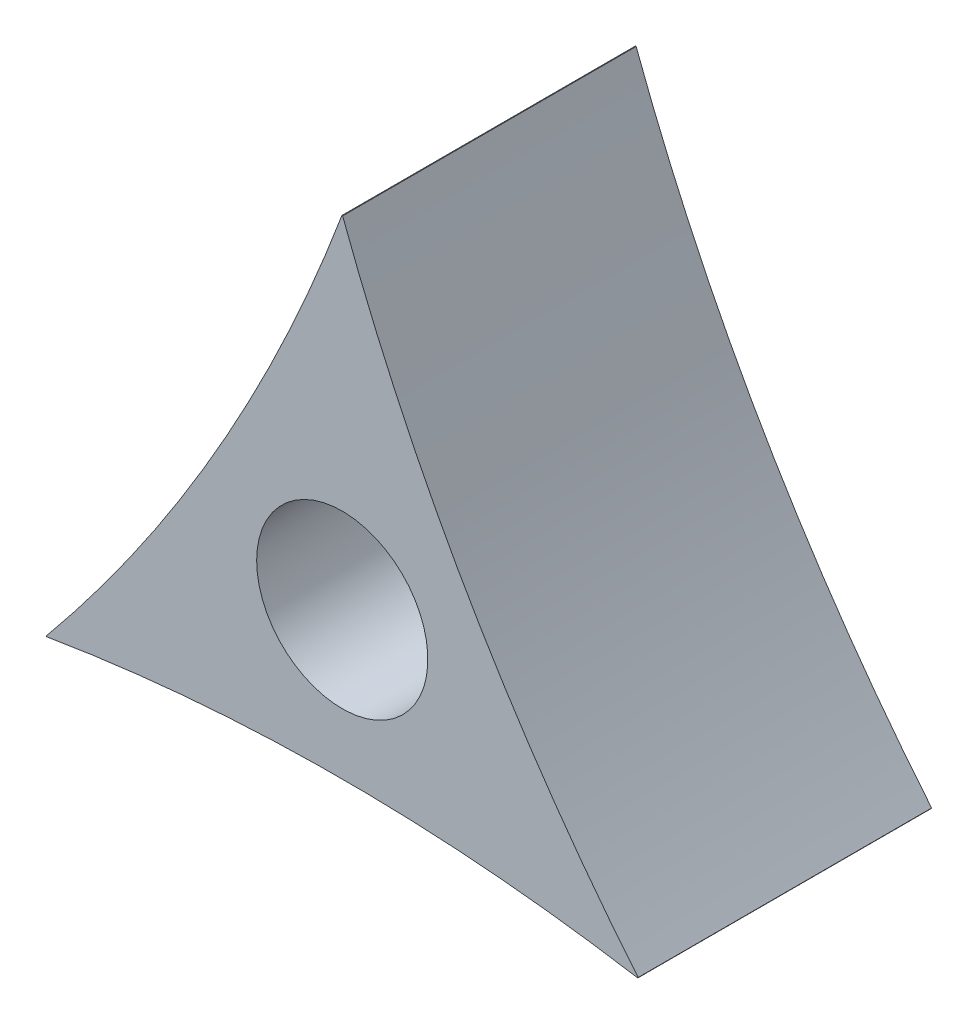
SolidWorks part; units mm, degrees
ref_plane "Front Plane" through (0, 0, 0) normal (0, 0, 1) x (1, 0, 0)
ref_plane "Top Plane" through (0, 0, 0) normal (0, 1, 0) x (1, 0, 0)
ref_plane "Right Plane" through (0, 0, 0) normal (1, 0, 0) x (0, 0, -1)
sketch "Sketch1" plane through (0, 0, 0) normal (0, 0, 1) x (1, 0, 0)
  line L0 (0, 0) -> (0, 177.8) construction
  line L1 (0, 0) -> (153.9793, -88.9) construction
  line L2 (0, 0) -> (-153.9793, -88.9) construction
  arc A0 (153.9793, -88.9) -> (-153.9793, -88.9) centre (0, -1005.6993) ccw
  arc A1 (153.9793, -88.9) -> (0, 177.8) centre (870.9611, 502.8496) cw
  arc A2 (0, 177.8) -> (-153.9793, -88.9) centre (-870.9611, 502.8496) cw
  circle A3 centre (0, 0) radius 44.45
extrude "Boss-Extrude1" add sketch "Sketch1" along normal blind 152.4
sketch "Sketch2" plane through (0, 0, 152.4) normal (0, 0, 1) x (1, 0, 0)
  line L0 (154.3603, -88.2401) -> (153.5983, -89.5599)
  line L1 (0, 0) -> (153.9793, -88.9) construction
  line L2 (0, 0) -> (0, 9.1868) construction
  line L4 (153.9204, -87.9861) -> (153.1584, -89.3059)
  line L5 (153.1584, -89.3059) -> (153.5983, -89.5599)
  line L6 (153.9204, -87.9861) -> (154.3603, -88.2401)
  line L7 (0, 0) -> (-153.9793, -88.9) construction
  line L8 (-153.9204, -87.9861) -> (-154.3603, -88.2401)
  line L9 (-153.1584, -89.3059) -> (-153.5983, -89.5599)
  line L10 (-153.9204, -87.9861) -> (-153.1584, -89.3059)
  line L11 (-154.3603, -88.2401) -> (-153.5983, -89.5599)
  line L12 (0, 0) -> (107.477, 0) construction
  line L29 (0, 0) -> (0, 177.8) construction
  line L30 (0.762, 177.292) -> (0.762, 177.8)
  line L31 (-0.762, 177.292) -> (-0.762, 177.8)
  line L34 (0.762, 177.292) -> (-0.762, 177.292)
  line L35 (0.762, 177.8) -> (-0.762, 177.8)
extrude "Cut-Extrude1" cut sketch "Sketch2" against normal through all
equation "\"D4@Sketch1\"=\"RRS\"-0.5"
equation "\"D1@Sketch1\"=\"R\""
equation "\"D2@Sketch1\"=\"R\"/2"
equation "\"D1@Boss-Extrude1\"=\"W\""
equation "\"E\"= 2.000000"
equation "\"R\"= 7.000000"
equation "\"RRS\"= 37.100000"
equation "\"HHS\"= 9.000000"
equation "\"W\"= 6.000000"
equation "\"D1@Sketch2\"=\"W\"/100"
equation "\"D2@Sketch2\"=\"W\"/300"
